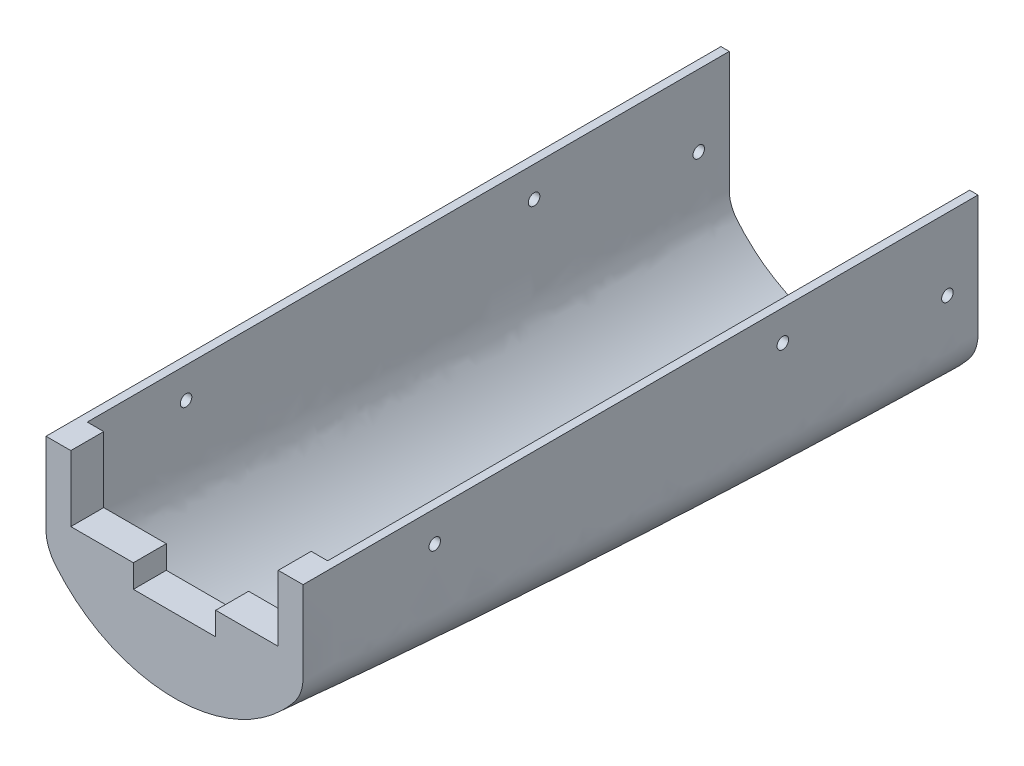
SolidWorks part; units mm, degrees
ref_plane "Front Plane" through (0, 0, 0) normal (0, 0, 1) x (1, 0, 0)
ref_plane "Top Plane" through (0, 0, 0) normal (0, 1, 0) x (1, 0, 0)
ref_plane "Right Plane" through (0, 0, 0) normal (1, 0, 0) x (0, 0, -1)
ref_plane "2nd Plane" through (0, 0, 154) normal (0, 0, 1) x (1, 0, 0)
ref_plane "3rd Plane" through (0, 0, 350) normal (0, 0, 1) x (1, 0, 0)
sketch "Sketch2" plane through (0, 0, 154) normal (0, 0, 1) x (1, 0, 0)
  line L3 (36.5, 0) -> (36.5, -36.6982)
  line L4 (-36.5, 0) -> (36.5, 0)
  line L5 (-36.5, 0) -> (-36.5, -36.6982)
  line L6 (-26.5, -36.6982) -> (26.5, -36.6982) construction
  arc A3 (-34.2372, -43.0335) -> (34.2372, -43.0335) centre (0, -15) ccw
  arc A4 (34.2372, -43.0335) -> (36.5, -36.6982) centre (26.5, -36.6982) ccw
  arc A5 (-36.5, -36.6982) -> (-34.2372, -43.0335) centre (-26.5, -36.6982) ccw
  dimension "D1" = 44.25
  dimension "D4" = 10
  dimension "D5" = 36.6982
  dimension "D2" = 15
  dimension "D3" = 73
sketch "Sketch3" plane through (0, 0, 350) normal (0, 0, 1) x (1, 0, 0)
  line L0 (-36.5, 0) -> (36.5, 0)
  line L1 (36.5, 0) -> (36.5, -25.3014)
  line L3 (-36.5, 0) -> (-36.5, -25.3014)
  line L6 (26.5, -25.3014) -> (-26.5, -25.3014) construction
  arc A0 (-34.2941, -31.5665) -> (34.2941, -31.5665) centre (0, -4) ccw
  arc A1 (-36.5, -25.3014) -> (-34.2941, -31.5665) centre (-26.5, -25.3014) ccw
  arc A2 (36.5, -25.3014) -> (34.2941, -31.5665) centre (26.5, -25.3014) cw
  point P16 (-36.5, -30.5713)
  point P19 (36.5, -30.5713)
  dimension "D1" = 44
  dimension "D2" = 4
  dimension "D3" = 10
  dimension "D5" = 25.3014
  dimension "D4" = 73
sketch3d "3DSketch1"
  line L1 (-36.5, 0, 154) -> (-36.5, 0, 350)
sketch3d "3DSketch2"
  line L0 (0, -48, 350) -> (0, 0, 350) construction
  line L2 (-36.5, 0, 350) -> (36.5, 0, 350) construction
  line L3 (0, -15, 154) -> (0, -59.25, 154) construction
  line L4 (0, -48, 350) -> (0, -48, 429.2347) construction
  line L5 (0, -59.25, 154) -> (0, -59.25, 223.0291) construction
  arc A0 (0, -48, 350) -> (0, -59.25, 154) centre (0, 1653.7528, 154) cw
  arc A1 (-34.2372, -43.0335, 154) -> (34.2372, -43.0335, 154) centre (0, -15, 154) ccw construction
  arc A3 (-34.2941, -31.5665, 350) -> (34.2941, -31.5665, 350) centre (0, -4, 350) ccw construction
  point P9 (0, -15, 198.25)
  point P11 (1713.0028, 1653.7528, 154)
  point P19 (0, -4, 394)
sketch3d "3DSketch3"
  line L1 (36.5, 0, 154) -> (36.5, 0, 350)
loft "Loft1" add profiles "Sketch2", "Sketch3"
shell "Shell1" thickness 2.54
sketch "Sketch4" plane through (0, 0, 360) normal (0, 0, 1) x (1, 0, 0)
  line L1 (-12.5, 0) -> (12.5, 0)
  line L2 (-12.5, 0) -> (-12.5, -27)
  line L3 (-12.5, -27) -> (12.5, -27)
  line L4 (12.5, 0) -> (12.5, -27)
  line L5 (0, 0) -> (0, -27) construction
  line L6 (39.04, 0) -> (-39.04, 0) construction
  dimension "D1" = 25
  dimension "D2" = 27
extrude "Cut-Extrude1" cut sketch "Sketch4" against normal through all
sketch "Sketch5" plane through (0, 0, 360) normal (0, 0, 1) x (1, 0, 0)
  line L0 (0, 0) -> (0, -27) construction
  line L1 (-12.5, 0) -> (-31.5, 0)
  line L2 (-12.5, 0) -> (-12.5, -20)
  line L3 (-12.5, -20) -> (-31.5, -20)
  line L4 (-31.5, 0) -> (-31.5, -20)
  line L5 (-12.5, -27) -> (12.5, -27) construction
  line L6 (31.5, 0) -> (31.5, -20)
  line L7 (12.5, -20) -> (31.5, -20)
  line L8 (12.5, 0) -> (12.5, -20)
  line L9 (12.5, 0) -> (31.5, 0)
  line L10 (-12.5, 0) -> (-39.04, 0) construction
  line L11 (-12.5, 0) -> (-12.5, -27) construction
  dimension "D1" = 20
  dimension "D2" = 19
extrude "Cut-Extrude2" cut sketch "Sketch5" against normal through all
ref_plane "Plane1" through (0, 0, 308.66) normal (0, 0, -1) x (-1, 0, 0)
sketch "Sketch12" plane through (0, 0, 154) normal (0, 0, -1) x (-1, 0, 0)
  line L1 (-59.5783, 19.6771) -> (54.0323, 19.6771)
  line L2 (-59.5783, 19.6771) -> (-59.5783, -92.5784)
  line L3 (-59.5783, -92.5784) -> (54.0323, -92.5784)
  line L4 (54.0323, 19.6771) -> (54.0323, -92.5784)
extrude "Cut-Extrude5" cut sketch "Sketch12" against normal blind 1
sketch "Sketch13" plane through (0, 0, 0) normal (1, 0, 0) x (0, 0, -1)
  line L0 (-214.286, -9.286) -> (-320, -9.286) construction
  line L1 (-154, 0) -> (-350, 0) construction
  line L3 (-155, -59.2497) -> (-155, 0) construction
  circle A0 centre (-214.286, -9.286) radius 1.75
  circle A1 centre (-320, -9.286) radius 1.75
  circle A2 centre (-164.286, -21.7876) radius 1.75
  dimension "D3" = 9.286
  dimension "D4" = 12.5016
  dimension "D5" = 50
  dimension "D6" = 3.5
  dimension "D1" = 105.714
  dimension "D2" = 9.286
extrude "Cut-Extrude6" cut sketch "Sketch13" against normal through all both and the other way through all
